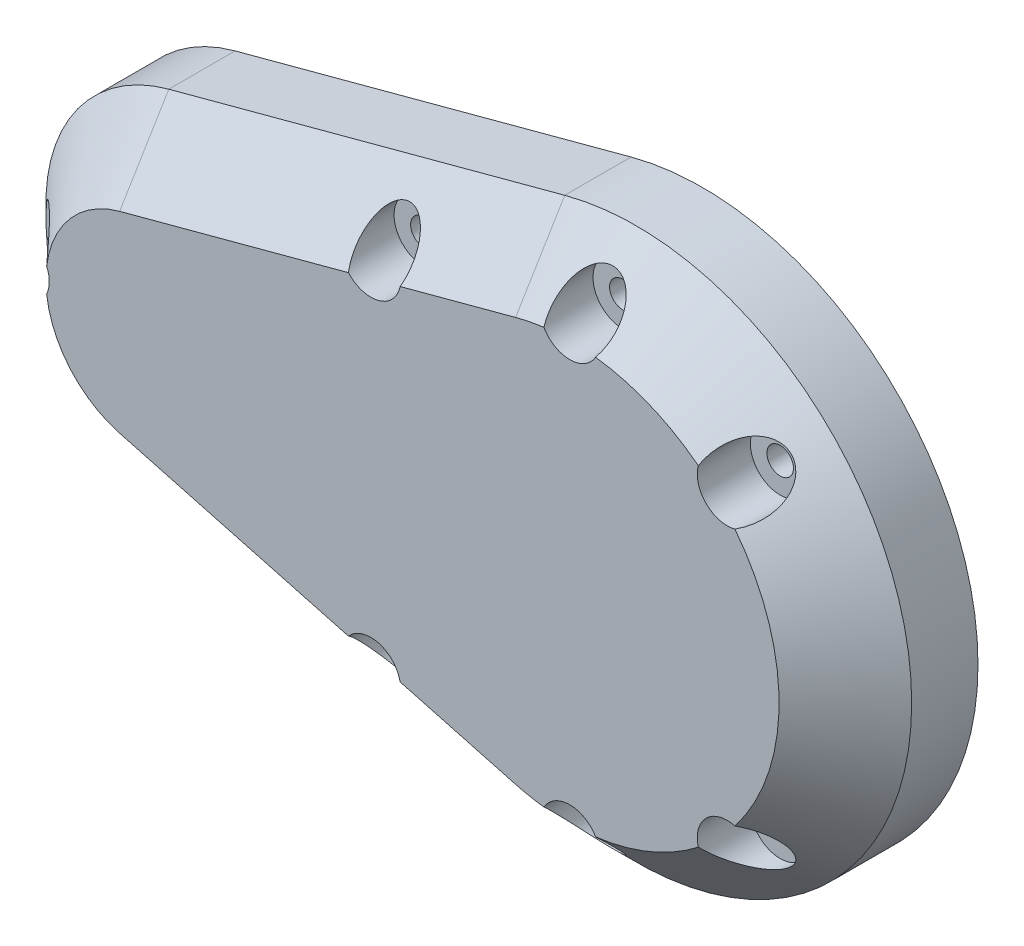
SolidWorks part; units mm, degrees
ref_plane "Front Plane" through (0, 0, 0) normal (0, 0, 1) x (1, 0, 0)
ref_plane "Top Plane" through (0, 0, 0) normal (0, 1, 0) x (1, 0, 0)
ref_plane "Right Plane" through (0, 0, 0) normal (1, 0, 0) x (0, 0, -1)
sketch "Sketch1" plane through (0, 0, 0) normal (0, 0, 1) x (1, 0, 0)
  line L12 (-28.4649, -10.78) -> (-37.8142, -8.2748)
  line L13 (-37.8142, -8.2748) -> (-52.7687, -29.6321)
  line L14 (-52.7687, -29.6321) -> (43.1926, -55.3448)
  line L15 (43.1926, -55.3448) -> (43.7361, -53.3164)
  line L16 (44.9608, -52.6092) -> (49.549, -53.8386)
  line L17 (49.549, -53.8386) -> (54.2854, -36.1622)
  line L18 (56.1225, -35.1015) -> (63.5601, -37.0944)
  line L19 (64.6208, -38.9316) -> (59.8844, -56.608)
  line L20 (59.8844, -56.608) -> (68.0948, -58.808)
  line L21 (68.0948, -58.808) -> (73.6335, -38.1372)
  line L22 (73.6335, -38.1372) -> (12.4485, -21.7427)
  line L23 (6.2212, 20.0741) -> (-23.6352, 12.0741)
  line L34 (6.2212, -20.0741) -> (-23.6352, -12.0741)
  line L35 (6.2212, 20.0741) -> (-23.6352, 12.0741)
  arc A7 (44.9608, -52.6092) -> (43.7361, -53.3164) centre (44.702, -53.5752) ccw
  arc A8 (56.1225, -35.1015) -> (54.2854, -36.1622) centre (55.7343, -36.5504) ccw
  arc A9 (64.6208, -38.9316) -> (63.5601, -37.0944) centre (63.1719, -38.5433) ccw
  arc A10 (12.555, -20.7603) -> (12.4485, -21.7427) centre (12.5779, -21.2597) ccw
  arc A11 (12.555, -20.7603) -> (6.2212, 20.0741) centre (11.6, 0) ccw
  arc A12 (-23.6352, 12.0741) -> (-28.0302, -9.901) centre (-20.4, 0) ccw
  arc A13 (-28.4649, -10.78) -> (-28.0302, -9.901) centre (-28.3355, -10.297) ccw
  arc A18 (6.2212, -20.0741) -> (6.2212, 20.0741) centre (11.6, 0) ccw
  arc A19 (-23.6352, 12.0741) -> (-23.6352, -12.0741) centre (-20.4, 0) ccw
  dimension "D1" = 0
extrude "Boss-Extrude1" add sketch "Sketch1" along normal blind 10
chamfer "Chamfer1" distance 5 angle 45 4 edges at (-8.707, -16.0741, 10) (-32.9, 0, 10) (-8.707, 16.0741, 10) (32.3822, 0, 10)
sketch "Sketch2" plane through (0, 0, 0) normal (0, 0, -1) x (-1, 0, 0)
  circle A0 centre (3.4, -13.355) radius 1 construction
  circle A1 centre (29.9, 0) radius 1 construction
  circle A2 centre (-11.6, 16.7822) radius 1 construction
  circle A3 centre (3.4, 13.355) radius 1 construction
  circle A4 centre (-23.4668, 11.8668) radius 1 construction
  circle A5 centre (-23.4668, -11.8668) radius 1 construction
  circle A6 centre (-11.6, -16.7822) radius 1 construction
  circle A7 centre (3.4, -13.355) radius 1
  circle A8 centre (29.9, 0) radius 1
  circle A9 centre (-11.6, 16.7822) radius 1
  circle A10 centre (3.4, 13.355) radius 1
  circle A11 centre (-23.4668, 11.8668) radius 1
  circle A12 centre (-23.4668, -11.8668) radius 1
  circle A13 centre (-11.6, -16.7822) radius 1
extrude "Cut-Extrude1" cut sketch "Sketch2" against normal through all
sketch "Sketch3" plane through (0, 0, 10) normal (0, 0, 1) x (1, 0, 0)
  line L0 (11.6, 0) -> (23.4668, 11.8668) construction
  line L1 (11.6, 0) -> (11.6, 16.7822) construction
  line L2 (11.6, 16.7822) -> (16.2846, 16.7822) construction
  line L6 (-22.3411, -7.2444) -> (-3.1412, -12.3891)
  line L7 (-3.1412, -12.3891) -> (7.5153, -15.2444)
  line L8 (7.5153, 15.2444) -> (-3.1412, 12.3891)
  line L9 (-3.1412, 12.3891) -> (-22.3411, 7.2444)
  line L10 (-22.3411, -7.2444) -> (-3.1412, -12.3891) construction
  line L11 (-3.1412, -12.3891) -> (7.5153, -15.2444) construction
  line L12 (7.5153, 15.2444) -> (-3.1412, 12.3891) construction
  line L13 (-3.1412, 12.3891) -> (-22.3411, 7.2444) construction
  circle A0 centre (-3.4, -13.355) radius 2.25
  circle A1 centre (11.6, -16.7822) radius 2.25
  circle A2 centre (23.4668, -11.8668) radius 2.25
  circle A3 centre (23.4668, 11.8668) radius 2.25
  circle A5 centre (-3.4, 13.355) radius 2.25
  circle A6 centre (-29.9, 0) radius 2.25
  circle A7 centre (11.6, 16.7822) radius 2.25
  arc A13 (-22.3411, 7.2444) -> (-22.3411, -7.2444) centre (-20.4, 0) ccw
  arc A14 (7.5153, -15.2444) -> (11.6, -15.7822) centre (11.6, 0) ccw
  arc A15 (11.6, -15.7822) -> (22.7597, -11.1597) centre (11.6, 0) ccw
  arc A16 (22.7597, -11.1597) -> (22.7597, 11.1597) centre (11.6, 0) ccw
  arc A17 (22.7597, 11.1597) -> (11.6, 15.7822) centre (11.6, 0) ccw
  arc A18 (11.6, 15.7822) -> (7.5153, 15.2444) centre (11.6, 0) ccw
  arc A19 (-22.3411, 7.2444) -> (-22.3411, -7.2444) centre (-20.4, 0) ccw construction
  arc A20 (7.5153, -15.2444) -> (11.6, -15.7822) centre (11.6, 0) ccw construction
  arc A21 (11.6, -15.7822) -> (22.7597, -11.1597) centre (11.6, 0) ccw construction
  arc A22 (22.7597, -11.1597) -> (22.7597, 11.1597) centre (11.6, 0) ccw construction
  arc A23 (22.7597, 11.1597) -> (11.6, 15.7822) centre (11.6, 0) ccw construction
  arc A24 (11.6, 15.7822) -> (7.5153, 15.2444) centre (11.6, 0) ccw construction
  point P18 (-29.9, 0)
  point P32 (11.6, 0)
  dimension "D1" = 4.5
  dimension "D2" = 4.5
  dimension "D3" = 4.5
  dimension "D4" = 4.5
  dimension "D5" = 4.5
  dimension "D6" = 4.5
  dimension "D9" = 4.5
  dimension "D8" = 1
  dimension "D7" = 0
extrude "Cut-Extrude2" cut sketch "Sketch3" against normal blind 4
